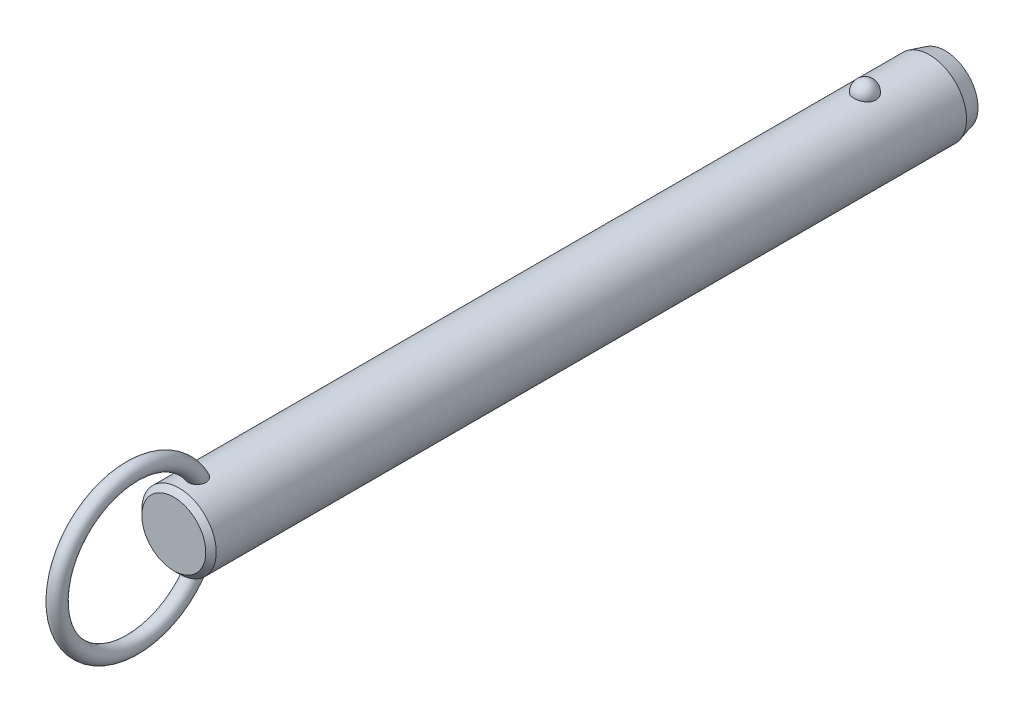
SolidWorks part; units mm, degrees
ref_plane "Front Plane" through (0, 0, 0) normal (0, 0, 1) x (1, 0, 0)
ref_plane "Top Plane" through (0, 0, 0) normal (0, 1, 0) x (1, 0, 0)
ref_plane "Right Plane" through (0, 0, 0) normal (1, 0, 0) x (0, 0, -1)
sketch "Sketch2" plane through (0, 0, 0) normal (0, 0, 1) x (1, 0, 0)
  circle A0 centre (0, 0) radius 7.1
  point P3 (0, 7.1)
  dimension "D1" = 14.2
extrude "Boss-Extrude1" add sketch "Sketch2" along normal blind 121.9
sketch "Sketch3" plane through (0, 0, 0) normal (0, 0, -1) x (-1, 0, 0)
  circle A0 centre (0, 0) radius 7.1
  dimension "D1" = 14.2
extrude "Boss-Extrude2" add sketch "Sketch3" along normal blind 17.4
chamfer "Chamfer1" distance 3 angle 15 1 edges at (-7.1, 0, -17.4)
sketch "Sketch12" plane through (0, 0, 0) normal (1, 0, 0) x (0, 0, -1)
  line L0 (-121.9, 7.1) -> (-121.9, -7.1) construction
  point P0 (-121.9, 0)
sketch "Sketch13" plane through (0, 0, 0) normal (1, 0, 0) x (0, 0, -1)
  circle A0 centre (-137.75, 0) radius 15.85
  point P2 (-121.9, 0)
  dimension "D1" = 31.7
sketch "Sketch14" plane through (0, 0, 0) normal (0, 1, 0) x (1, 0, 0)
  circle A0 centre (0, -123.4) radius 1.5
  point P2 (0, -121.9)
  dimension "D1" = 3
sweep "Sweep1" add profiles "Sketch14" path "Sketch13"
sketch "Sketch15" plane through (0, 0, 121.9) normal (0, 0, 1) x (1, 0, 0)
  circle A0 centre (0, 0) radius 7.1
  dimension "D1" = 14.2
extrude "Boss-Extrude3" add sketch "Sketch15" along normal blind 7.92
chamfer "Chamfer2" distance 1 angle 45 1 edges at (7.1, 0, 129.82)
sketch "Sketch18" plane through (0, 0, 0) normal (1, 0, 0) x (0, 0, -1)
  line L0 (14.4, 7.1) -> (-123.5792, 7.1) construction
  line L1 (2.1, 9.2) -> (2.1, 5)
  line L2 (-123.5792, -7.1) -> (14.4, -7.1) construction
  arc A0 (2.1, 9.2) -> (2.1, 5) centre (2.1, 7.1) ccw
  point P4 (0, 7.1)
  dimension "D1" = 16.3
revolve "Revolve1" add sketch "Sketch18" angle 360 about L1
